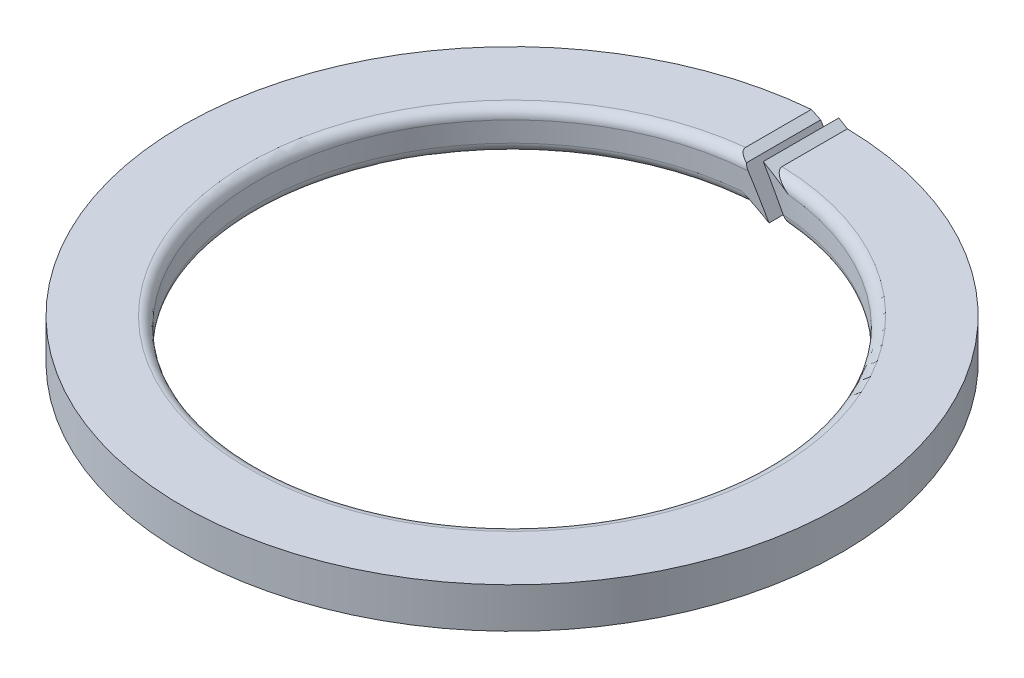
SolidWorks part; units mm, degrees
ref_plane "Front Plane" through (0, 0, 0) normal (0, 0, 1) x (1, 0, 0)
ref_plane "Top Plane" through (0, 0, 0) normal (0, 1, 0) x (1, 0, 0)
ref_plane "Right Plane" through (0, 0, 0) normal (1, 0, 0) x (0, 0, -1)
other "Configuration Table"
sketch "BodySke" plane through (0, 0, 0) normal (0, 0, 1) x (1, 0, 0)
  line L0 (0, 0) -> (0, 99.9596) construction
  line L1 (0, 0) -> (50.5, 0) construction
  line L3 (50.5, -10) -> (65.5, -10)
  line L4 (50.5, -10) -> (50.5, 10)
  line L5 (50.5, 10) -> (65.5, 10)
  line L6 (65.5, -10) -> (65.5, 10)
  line L7 (50.5, -4) -> (65.5, -4) construction
  line L8 (50.5, -4) -> (50.5, 4) construction
  line L9 (50.5, 4) -> (65.5, 4) construction
  line L10 (65.5, -4) -> (65.5, 4) construction
  dimension "Inner_dia" = 101
  dimension "Outer_dia" = 131
  dimension "D3" = 20
  dimension "Thickness" = 8
revolve "BaseBody" add sketch "BodySke" angle 360 about L0
sketch "Cut-ExtraSke" plane through (0, 0, 0) normal (0, 0, 1) x (1, 0, 0)
  line L1 (65.5, -4) -> (-65.5, -4)
  line L2 (65.5, -4) -> (65.5, -10)
  line L3 (65.5, -10) -> (-65.5, -10)
  line L4 (-65.5, -4) -> (-65.5, -10)
  line L5 (65.5, 4) -> (-65.5, 4)
  line L6 (65.5, 4) -> (65.5, 10)
  line L7 (65.5, 10) -> (-65.5, 10)
  line L8 (-65.5, 4) -> (-65.5, 10)
extrude "Cut-Extra" cut sketch "Cut-ExtraSke" along normal through all
sketch "ASke" plane through (0, 0, 0) normal (0, 0, 1) x (1, 0, 0)
  line L0 (0, -16.7192) -> (0, 28.802) construction
  line L1 (65.5, 4) -> (-65.5, 4) construction
  line L2 (0.5774, -5) -> (-4.6188, 4) construction
  line L4 (0.5774, -5) -> (-1.1547, -4)
  line L7 (-5.7735, 4) -> (-4.0415, 3)
  line L8 (-0.5774, 5) -> (4.6188, -4) construction
  line L9 (4.0415, -3) -> (5.7735, -4)
  line L10 (-65.5, 10) -> (65.5, 10)
  line L11 (-0.5774, 5) -> (1.1547, 4)
  line L12 (65.5, -4) -> (-65.5, -4) construction
  line L13 (65.5, 10) -> (65.5, 4)
  line L14 (65.5, 4) -> (1.1547, 4)
  line L15 (5.7735, -4) -> (65.5, -4)
  line L16 (65.5, -4) -> (65.5, -10)
  line L17 (65.5, -10) -> (-65.5, -10)
  line L18 (-65.5, -10) -> (-65.5, -4)
  line L19 (-65.5, -4) -> (-1.1547, -4)
  line L20 (0.5774, -5) -> (-4.0415, 3)
  line L21 (4.0415, -3) -> (-0.5774, 5)
  line L22 (-5.7735, 4) -> (-65.5, 4)
  line L23 (-65.5, 4) -> (-65.5, 10)
  line L24 (-65.5, 10) -> (-65.5, 4) construction
  line L25 (-65.5, -4) -> (-65.5, -10) construction
  line L26 (50.5, 10) -> (65.5, 10) construction
  line L27 (50.5, -10) -> (65.5, -10) construction
  point P11 (0, -4)
  point P12 (0, 4)
extrude "Type-A" cut sketch "ASke" against normal through all
sketch "BSke" plane through (0, 0, 0) normal (0, 0, 1) x (1, 0, 0)
  line L0 (0, 0) -> (0, 31.0126) construction
  line L1 (0, 0) -> (0, 99.9596) construction
  line L2 (0, -4) -> (-4.6188, 4)
  line L3 (65.5, 4) -> (-65.5, 4) construction
  line L4 (0, 4) -> (4.6188, -4)
  line L5 (-65.5, -4) -> (65.5, -4) construction
  line L6 (-50.5, -4) -> (50.5, -4) construction
  line L7 (0, -4) -> (-65.5, -4)
  line L8 (-65.5, -4) -> (-65.5, -10)
  line L9 (-65.5, -10) -> (65.5, -10)
  line L10 (65.5, -10) -> (65.5, -4)
  line L11 (65.5, -4) -> (4.6188, -4)
  line L12 (0, 4) -> (65.5, 4)
  line L13 (65.5, 4) -> (65.5, 10)
  line L14 (65.5, 10) -> (-65.5, 10)
  line L15 (-65.5, 10) -> (-65.5, 4)
  line L16 (-65.5, 4) -> (-4.6188, 4)
  line L17 (-65.5, 4) -> (-65.5, -4) construction
  dimension "Angle" = 30
extrude "Type-B" [suppressed] cut sketch "BSke" against normal through all
fillet "Fillet1" radius 2 2 edges at (-2.3149, -4, 50.4469) (2.3149, 4, 50.4469)
equation "\"D4@ASke\" = \"Offset@ASke\""
equation "\"D5@ASke\" = \"Offset@ASke\""
equation "\"D6@ASke\" = \"Offset@ASke\""
